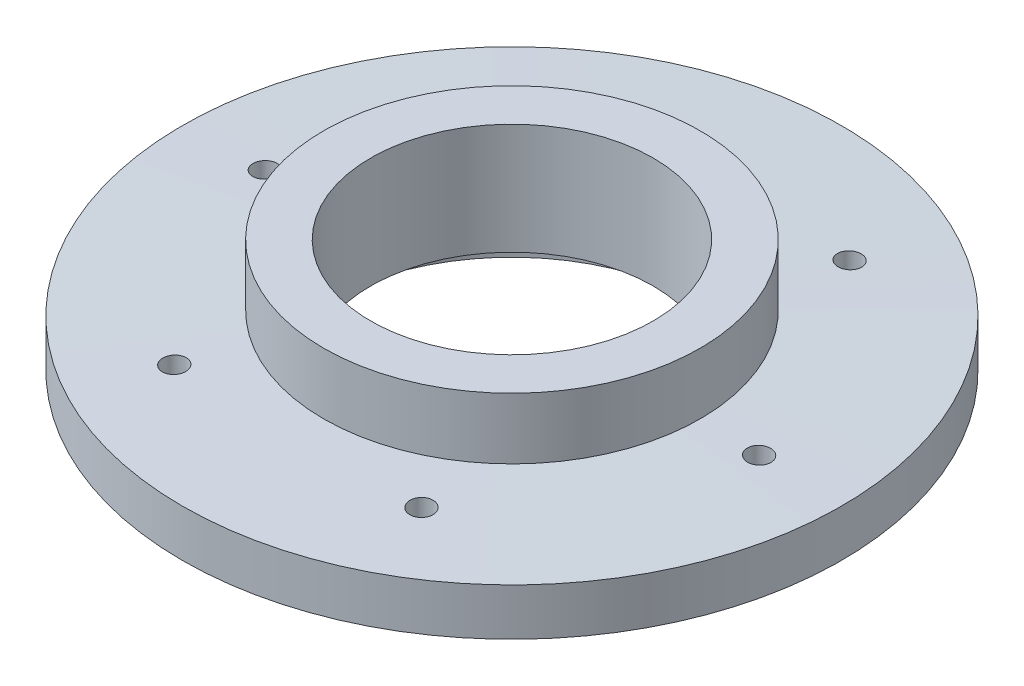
SolidWorks part; units mm, degrees
ref_plane "Plan de face" through (0, 0, 0) normal (0, 0, 1) x (1, 0, 0)
ref_plane "Plan de dessus" through (0, 0, 0) normal (0, 1, 0) x (1, 0, 0)
ref_plane "Plan de droite" through (0, 0, 0) normal (1, 0, 0) x (0, 0, -1)
ref_plane "Plan4" through (0, 0, 0) normal (0, 0, -1) x (-1, 0, 0)
sketch "Esquisse1" plane through (0, 0, 0) normal (0, 0, -1) x (-1, 0, 0)
  line L0 (-8, 1.6) -> (0, 1.6)
  line L1 (0, 1.6) -> (0, 6.3095)
  line L2 (0, 6.3095) -> (-8, 6.3095)
  line L3 (-8, 6.3095) -> (-8, 3.7095)
  line L4 (-8, 3.7095) -> (-14, 3.5)
  line L5 (-14, 3.5) -> (-14, 1.5)
  line L6 (-14, 1.5) -> (-8, 0)
  line L7 (-8, 0) -> (-8, 1.6)
  line L8 (0, 0) -> (0, 6.3095) construction
revolve "Révolution1" add sketch "Esquisse1" angle 360 about L8
hole_wizard "Perçage1" positions "Esquisse3" profile "Esquisse2" legacy
sketch "Esquisse3" plane through (0, 1.6, 0) normal (0, -1, 0) x (1, 0, 0)
  point P0 (0, 0)
sketch "Esquisse2" plane through (0, 1.6, 0) normal (1, 0, 0) x (0, 0, -1)
  line L0 (0, 0) -> (0, 4.7095)
  line L1 (0, 4.7095) -> (6, 4.7095)
  line L2 (6, 4.7095) -> (6, 0)
  line L3 (6, 0) -> (0, 0)
  line L4 (0, 110) -> (0, -10) construction
  dimension "Diamètre" = 12
  dimension "Profondeur" = 4.7095
ref_plane "Plan5" through (0, 0, 0) normal (0.866, 0, 0.5) x (0, 1, 0)
sketch "Esquisse4" plane through (0, 0, 0) normal (0.866, 0, 0.5) x (0, 1, 0)
  line L0 (3.6397, 10) -> (3.6397, 10.5)
  line L1 (3.6397, 10.5) -> (0.5, 10.5)
  line L2 (0.5, 10.5) -> (0.5, 10)
  line L3 (0.5, 10) -> (3.6397, 10)
  line L4 (3.6397, 10.5) -> (0.5, 10.5) construction
revolve "Enlèvement de matière-Révolution1" cut sketch "Esquisse4" angle 360 about L4
sketch "Esquisse5" plane through (0, 0, 0) normal (0, 0, 1) x (1, 0, 0)
  line L0 (-10, 3.6397) -> (-10.5, 3.6397)
  line L1 (-10.5, 3.6397) -> (-10.5, 0.5)
  line L2 (-10.5, 0.5) -> (-10, 0.5)
  line L3 (-10, 0.5) -> (-10, 3.6397)
  line L4 (-10.5, 3.6397) -> (-10.5, 0.5) construction
revolve "Enlèvement de matière-Révolution2" cut sketch "Esquisse5" angle 360 about L4
sketch "Esquisse6" plane through (0, 0, 0) normal (0.866, 0, 0.5) x (0, 1, 0)
  line L0 (3.6397, -10.5) -> (3.6397, -10)
  line L1 (3.6397, -10) -> (0.5, -10)
  line L2 (0.5, -10) -> (0.5, -10.5)
  line L3 (0.5, -10.5) -> (3.6397, -10.5)
  line L4 (0.5, -10.5) -> (3.6397, -10.5) construction
revolve "Enlèvement de matière-Révolution3" cut sketch "Esquisse6" angle 360 about L4
sketch "Esquisse7" plane through (0, 0, 0) normal (0, 0, 1) x (1, 0, 0)
  line L0 (10.5, 3.6397) -> (10, 3.6397)
  line L1 (10, 3.6397) -> (10, 0.5)
  line L2 (10, 0.5) -> (10.5, 0.5)
  line L3 (10.5, 0.5) -> (10.5, 3.6397)
  line L4 (10.5, 0.5) -> (10.5, 3.6397) construction
revolve "Enlèvement de matière-Révolution4" cut sketch "Esquisse7" angle 360 about L4
ref_plane "Plan6" through (0, 0, 0) normal (0.866, 0, -0.5) x (0, 1, 0)
sketch "Esquisse8" plane through (0, 0, 0) normal (0.866, 0, -0.5) x (0, 1, 0)
  line L0 (3.6397, 10.5) -> (3.6397, 11)
  line L1 (3.6397, 11) -> (0.5, 11)
  line L2 (0.5, 11) -> (0.5, 10.5)
  line L3 (0.5, 10.5) -> (3.6397, 10.5)
  line L4 (0.5, 10.5) -> (3.6397, 10.5) construction
revolve "Enlèvement de matière-Révolution5" cut sketch "Esquisse8" angle 360 about L4
ref_plane "Plan7" through (2.6163, 0, -4.2449) normal (-0.5247, 0, 0.8513) x (0, -1, 0)
sketch "Esquisse9" plane through (2.6163, 0, -4.2449) normal (-0.5247, 0, 0.8513) x (0, -1, 0)
  line L0 (-3.6397, -8.7404) -> (-3.6397, -9.2404)
  line L1 (-3.6397, -9.2404) -> (-0.5, -9.2404)
  line L2 (-0.5, -9.2404) -> (-0.5, -8.7404)
  line L3 (-0.5, -8.7404) -> (-3.6397, -8.7404)
  line L4 (-3.6397, -9.2404) -> (-0.5, -9.2404) construction
revolve "Enlèvement de matière-Révolution6" cut sketch "Esquisse9" angle 360 about L4
